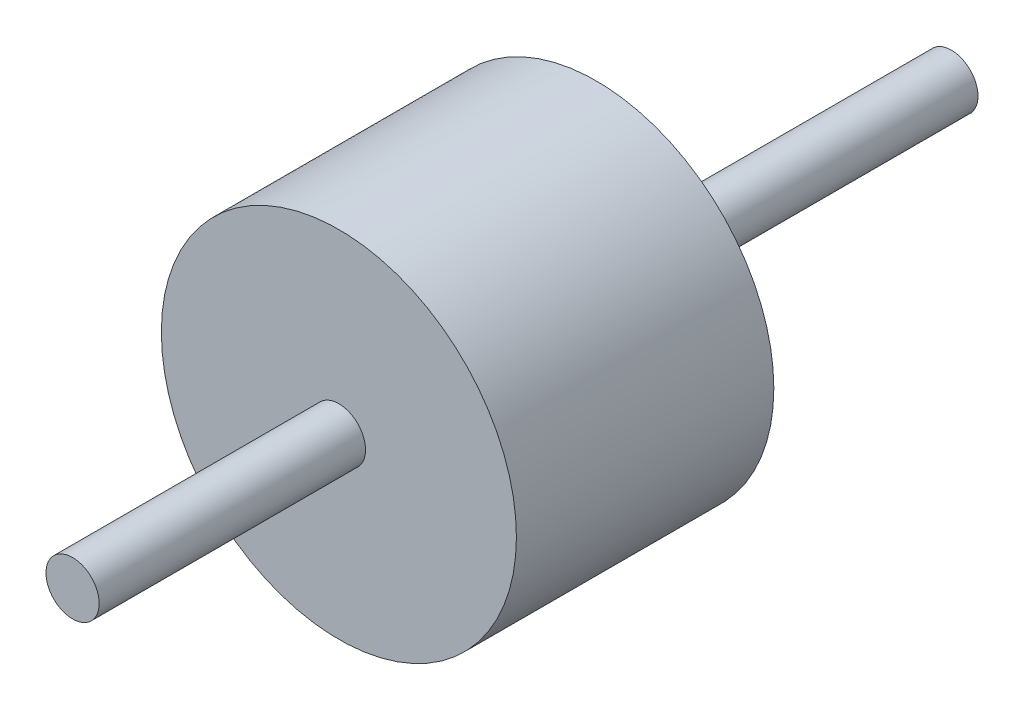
SolidWorks part; units mm, degrees
ref_plane "前视" through (0, 0, 0) normal (0, 0, 1) x (1, 0, 0)
ref_plane "上视" through (0, 0, 0) normal (0, 1, 0) x (1, 0, 0)
ref_plane "右视" through (0, 0, 0) normal (1, 0, 0) x (0, 0, -1)
sketch "草图1" plane through (0, 0, 0) normal (0, 0, 1) x (1, 0, 0)
  circle A0 centre (0, 0) radius 1
  dimension "D1" = 2
extrude "凸台-拉伸1" add sketch "草图1" along normal blind 1.45
sketch "草图2" plane through (0, 0, 1.45) normal (0, 0, 1) x (1, 0, 0)
  circle A0 centre (0, 0) radius 0.15
  dimension "D1" = 0.3
extrude "凸台-拉伸2" add sketch "草图2" along normal blind 1.5
sketch "草图3" plane through (0, 0, 0) normal (0, 0, -1) x (-1, 0, 0)
  circle A0 centre (0, 0) radius 0.15
  dimension "D1" = 0.3
extrude "凸台-拉伸3" add sketch "草图3" along normal blind 2
